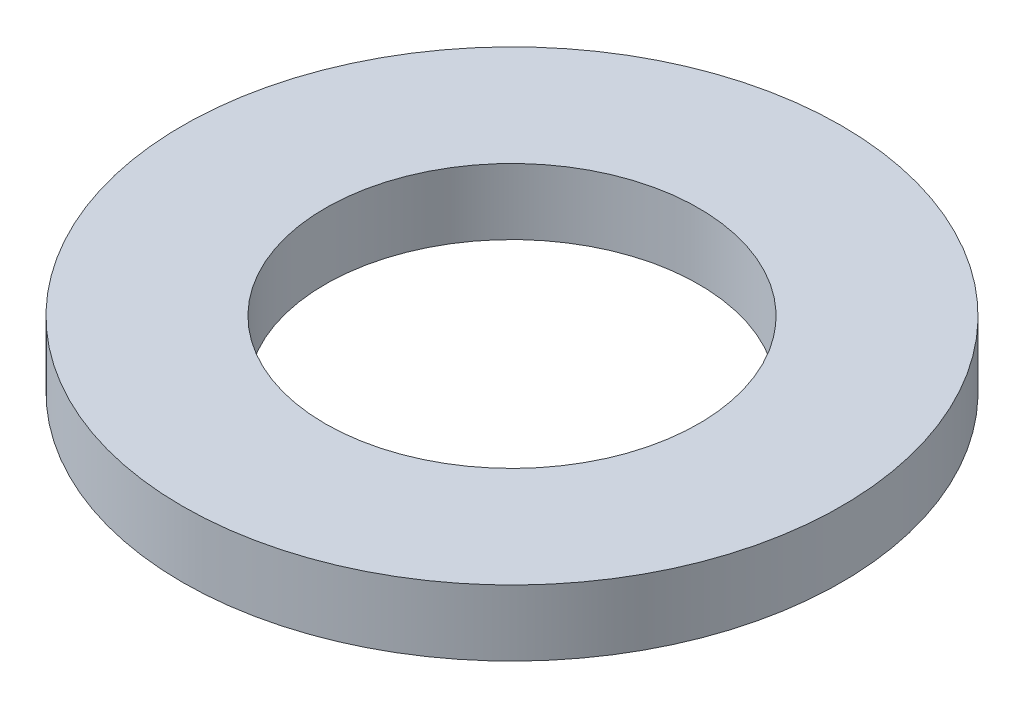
SolidWorks part; units mm, degrees
ref_plane "Plan de face" through (0, 0, 0) normal (0, 0, 1) x (1, 0, 0)
ref_plane "Plan de dessus" through (0, 0, 0) normal (0, 1, 0) x (1, 0, 0)
ref_plane "Plan de droite" through (0, 0, 0) normal (1, 0, 0) x (0, 0, -1)
sketch "Esquisse1" plane through (0, 0, 0) normal (0, 1, 0) x (1, 0, 0)
  circle A0 centre (0, 0) radius 15
  circle A1 centre (0, 0) radius 8.5
  dimension "D1" = 30
  dimension "D2" = 17
extrude "Extrusion1" add sketch "Esquisse1" along normal blind 3
